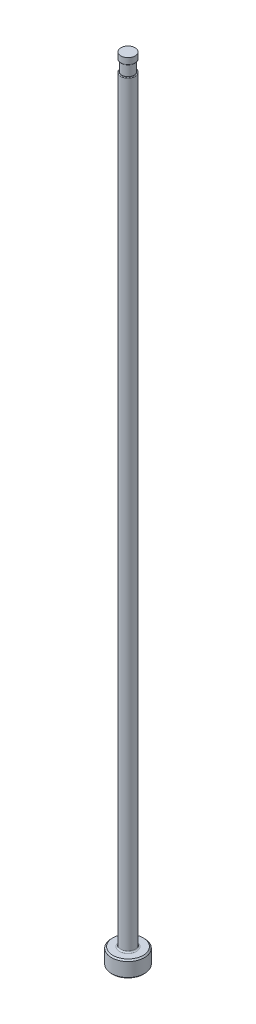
SolidWorks part; units mm, degrees
ref_plane "Front Plane" through (0, 0, 0) normal (0, 0, 1) x (1, 0, 0)
ref_plane "Top Plane" through (0, 0, 0) normal (0, 1, 0) x (1, 0, 0)
ref_plane "Right Plane" through (0, 0, 0) normal (1, 0, 0) x (0, 0, -1)
other "Configuration Table"
sketch "Sketch1" plane through (0, 0, 0) normal (0, 0, 1) x (1, 0, 0)
  line L0 (0, 259.9588) -> (0, -15.1925) construction
  line L1 (0, 0) -> (-3.175, 0)
  line L2 (-3.175, 0) -> (-3.175, 3.175)
  line L3 (-3.175, 3.175) -> (-1.3881, 3.175)
  line L4 (-1.3881, 3.175) -> (-1.3881, 152.4)
  line L5 (-1.3881, 152.4) -> (0, 152.4)
  line L6 (0, 152.4) -> (0, 0)
  dimension "L" = 152.4
  dimension "H" = 6.35
  dimension "T" = 3.175
  dimension "D" = 2.7762
revolve "Revolve1" add sketch "Sketch1" angle 360 about L0
chamfer "Chamfer1" distance 0.254 angle 45 2 edges at (0, 3.175, 3.175) (0, 0, 3.175)
fillet "Fillet1" radius 0.254 1 edges at (0, 3.175, 1.3881)
sketch "Sketch2" plane through (0, 0, 0) normal (0, 0, 1) x (1, 0, 0)
  line L0 (-1.3881, 152.4) -> (-1.3881, 3.429) construction
  line L1 (-1.3881, 151.13) -> (-1.1849, 151.13)
  line L2 (-1.3881, 151.13) -> (-1.3881, 149.098)
  line L3 (-1.3881, 149.098) -> (-1.1849, 149.098)
  line L4 (-1.1849, 151.13) -> (-1.1849, 149.098)
  line L5 (1.3881, 152.4) -> (-1.3881, 152.4) construction
  line L6 (0, 153.4483) -> (0, 147.3282) construction
  dimension "D1" = 2.032
  dimension "N" = 1.27
  dimension "FD" = 0.2032
  dimension "D3" = 2.3698
revolve "Vent Relief" cut sketch "Sketch2" angle 360 about L6
sketch "Sketch3" plane through (0, 0, 0) normal (0, 0, 1) x (1, 0, 0)
  line L0 (-1.1849, 150.114) -> (-1.1849, 86.614)
  line L1 (-1.1849, 151.13) -> (-1.1849, 149.098) construction
  line L2 (-1.3881, 149.098) -> (-1.3881, 3.429) construction
  line L3 (-1.3881, 85.4964) -> (-1.3881, 150.114)
  line L4 (-1.3881, 150.114) -> (-1.1849, 150.114)
  arc A0 (-1.1849, 86.614) -> (-1.3881, 85.4964) centre (-4.3599, 86.614) cw
  dimension "D1" = 3.175
  dimension "D2" = 63.5
extrude "D-Slot" cut sketch "Sketch3" against normal through all both and the other way through all
sketch "Sketch5" plane through (0, 0, 0) normal (0, 0, 1) x (1, 0, 0)
  line L0 (-1.3881, 151.13) -> (1.3881, 151.13) construction
  line L1 (-1.3881, 152.4) -> (-1.3754, 152.4)
  line L2 (-1.3881, 152.4) -> (-1.3881, 151.13)
  line L3 (-1.3881, 151.13) -> (-1.3754, 151.13)
  line L4 (-1.3754, 152.4) -> (-1.3754, 151.13)
  line L5 (0, 152.6877) -> (0, 150.5771) construction
  dimension "VP" = 0.0127
revolve "Vent Diameter" cut sketch "Sketch5" angle 360 about L5
fillet "Fillet2" radius 0.127 2 edges at (1.3881, 149.098, 0) (0, 151.13, 1.3754)
sketch "Pocket Sketch" plane through (0, 0, 0) normal (0, 0, 1) x (1, 0, 0)
  line L0 (-3.5719, 0) -> (-3.5719, 3.2004)
  line L1 (-3.5719, 3.2004) -> (-2.3485, 3.2004)
  line L2 (-1.5865, 3.9624) -> (-1.5865, 22.225)
  line L3 (-1.5865, 22.225) -> (0, 22.225)
  line L4 (0, 22.225) -> (0, 0)
  line L5 (0, 0) -> (-3.5719, 0)
  line L6 (0, 12.6104) -> (0, -2.4989) construction
  line L7 (-3.175, 2.921) -> (-3.175, 0.254) construction
  line L8 (2.921, 3.175) -> (-2.921, 3.175) construction
  line L9 (-1.3881, 85.4964) -> (-1.3881, 3.429) construction
  line L10 (-2.3485, 3.2004) -> (-1.5865, 3.9624)
  point P3 (-1.5865, 3.2004)
  dimension "D1" = 7.1437
  dimension "D2" = 0.3969
  dimension "D3" = 0.0254
  dimension "D4" = 0.1984
  dimension "D5" = 3.1731
  dimension "D6" = 22.225
